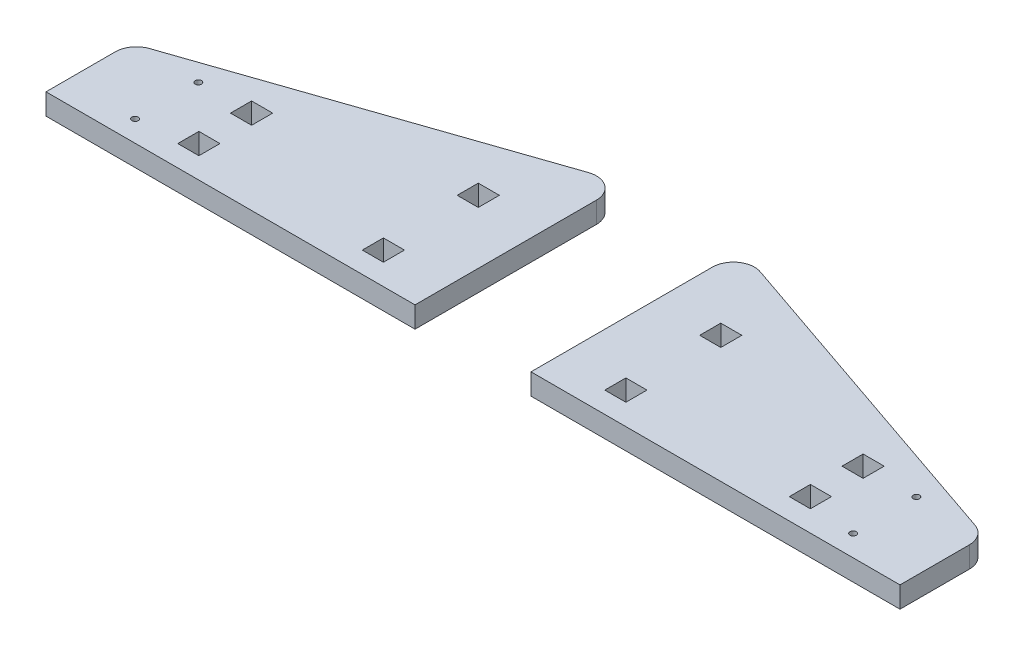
SolidWorks part; units mm, degrees
ref_plane "Front Plane" through (0, 0, 0) normal (0, 0, 1) x (1, 0, 0)
ref_plane "Top Plane" through (0, 0, 0) normal (0, 1, 0) x (1, 0, 0)
ref_plane "Right Plane" through (0, 0, 0) normal (1, 0, 0) x (0, 0, -1)
sketch "Sketch1" plane through (0, 0, 0) normal (0, 1, 0) x (1, 0, 0)
  line L0 (55, 0) -> (405, 0)
  line L1 (405, 0) -> (405, 80)
  line L2 (405, 80) -> (55, 200)
  line L3 (55, 200) -> (55, 0)
  dimension "D1" = 55
  dimension "D2" = 405
  dimension "D3" = 80
  dimension "D4" = 200
sketch "Sketch2" plane through (0, 0, 0) normal (0, 1, 0) x (1, 0, 0)
  line L0 (105, 130) -> (125, 130)
  line L1 (105, 40) -> (125, 40)
  line L2 (105, 40) -> (105, 20)
  line L3 (105, 20) -> (125, 20)
  line L4 (125, 40) -> (125, 20)
  line L5 (105, 130) -> (105, 110)
  line L6 (105, 110) -> (125, 110)
  line L7 (125, 130) -> (125, 110)
  line L8 (280, 90) -> (300, 90)
  line L9 (280, 40) -> (300, 40)
  line L10 (280, 40) -> (280, 20)
  line L11 (280, 20) -> (300, 20)
  line L12 (300, 40) -> (300, 20)
  line L13 (280, 90) -> (280, 70)
  line L14 (280, 70) -> (300, 70)
  line L15 (300, 90) -> (300, 70)
  line L16 (300, 20) -> (105, 20) construction
  line L17 (105, 20) -> (105, 0) construction
  line L23 (110, 20) -> (105, 20) construction
  circle A0 centre (340.525, 20) radius 3
  circle A1 centre (340.525, 80) radius 3
  point P16 (340.525, 20)
  dimension "D1" = 20
  dimension "D2" = 20
  dimension "D3" = 20
  dimension "D4" = 20
  dimension "D5" = 90
  dimension "D6" = 20
  dimension "D7" = 20
  dimension "D8" = 20
  dimension "D9" = 20
  dimension "D10" = 50
extrude "Boss-Extrude1" add sketch "Sketch1" along normal blind 20
extrude "Cut-Extrude2" cut sketch "Sketch2" along normal through all
fillet "Fillet1" radius 20 2 edges at (405, 10, -80) (55, 10, -200)
sketch "Sketch3" plane through (0, 0, 0) normal (0, 1, 0) x (1, 0, 0)
  line L0 (0, 0) -> (0, 218.8256) construction
ref_plane "Plane1" through (0, 0, 0) normal (1, 0, 0) x (0, 0, -1)
mirror "Mirror5" about plane through (0, 0, 0) normal (1, 0, 0)
